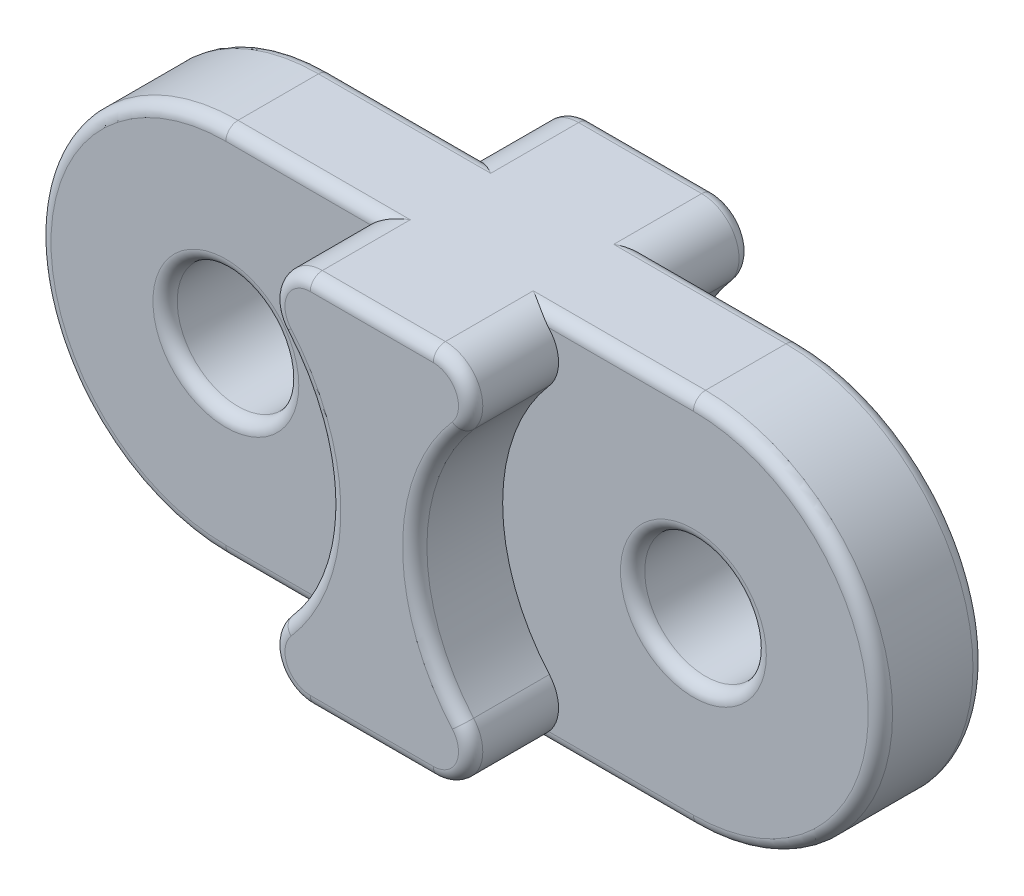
SolidWorks part; units mm, degrees
ref_plane "Front Plane" through (0, 0, 0) normal (0, 0, 1) x (1, 0, 0)
ref_plane "Top Plane" through (0, 0, 0) normal (0, 1, 0) x (1, 0, 0)
ref_plane "Right Plane" through (0, 0, 0) normal (1, 0, 0) x (0, 0, -1)
sketch "Sketch1" plane through (0, 0, 0) normal (0, 0, 1) x (1, 0, 0)
  line L0 (-31.75, 12.7) -> (0, 12.7)
  line L1 (-31.75, -12.7) -> (0, -12.7)
  arc A0 (0, -12.7) -> (0, 12.7) centre (0, 0) ccw
  arc A1 (-31.75, 12.7) -> (-31.75, -12.7) centre (-31.75, 0) ccw
  dimension "D2" = 12.7
  dimension "D1" = 31.75
extrude "Extrude1" add sketch "Sketch1" along normal mid plane 19.05
sketch "Sketch2" plane through (0, 0, 9.525) normal (0, 0, 1) x (1, 0, 0)
  circle A0 centre (0, 0) radius 12.954
  circle A1 centre (-31.75, 0) radius 12.954
  arc A2 (-31.75, 12.7) -> (-31.75, -12.7) centre (-31.75, 0) ccw construction
  dimension "D1" = 25.908
extrude "Cut-Extrude1" cut sketch "Sketch2" against normal blind 5.969
mirror "Mirror1" about plane through (0, 0, 0) normal (0, 0, 1) of "Cut-Extrude1"
sketch "Sketch3" plane through (0, 0, 3.556) normal (0, 0, 1) x (1, 0, 0)
  circle A0 centre (-31.75, 0) radius 4.1275
  circle A1 centre (0, 0) radius 4.1275
  dimension "D1" = 8.255
extrude "Cut-Extrude2" cut sketch "Sketch3" against normal through all
fillet "Fillet1" radius 2.54 8 edges at (-29.1973, -12.7, -6.5405) (-2.5527, -12.7, -6.5405) (-2.5527, -12.7, 6.5405) (-29.1973, -12.7, 6.5405) (-2.5527, 12.7, 6.5405) (-2.5527, 12.7, -6.5405) (-29.1973, 12.7, -6.5405) (-29.1973, 12.7, 6.5405)
fillet "Fillet2" radius 0.8255 32 edges at (-15.875, 12.7, -9.525) (-22.3633, 11.2138, -9.525) (-18.796, 0, -9.525) (-22.3633, -11.2138, -9.525) (-15.875, -12.7, -9.525) (-9.3867, -11.2138, -9.525) (-12.954, 0, -9.525) (-9.3867, 11.2138, 9.525) (-12.954, 0, 9.525) (-9.3867, -11.2138, 9.525) (-15.875, -12.7, 9.525) (-22.3633, -11.2138, 9.525) (-18.796, 0, 9.525) (-22.3633, 11.2138, 9.525) (-25.9011, -12.7, -3.556) (-44.45, 0, -3.556) (-5.8489, -12.7, -3.556) (12.7, 0, -3.556) (-5.8489, -12.7, 3.556) (12.7, 0, 3.556) (-25.9011, 12.7, 3.556) (-25.9011, -12.7, 3.556) (-9.3867, 11.2138, -9.525) (-15.875, 12.7, 9.525) (-25.9011, 12.7, -3.556) (-5.8489, 12.7, -3.556) (-5.8489, 12.7, 3.556) (-44.45, 0, 3.556) (-35.8775, 0, -3.556) (-4.1275, 0, -3.556) (4.1275, 0, 3.556) (-27.6225, 0, 3.556)
